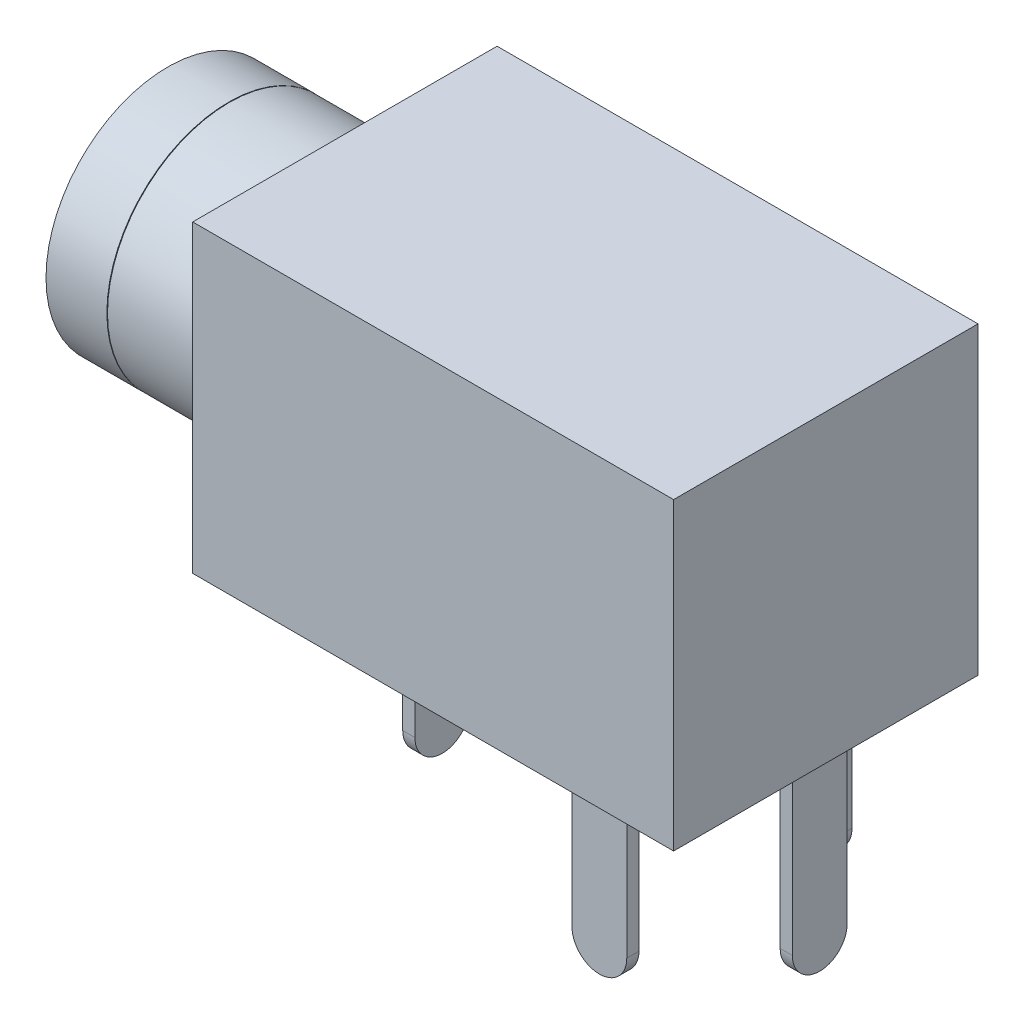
SolidWorks part; units mm, degrees
ref_plane "Plan de face" through (0, 0, 0) normal (0, 0, 1) x (1, 0, 0)
ref_plane "Plan de dessus" through (0, 0, 0) normal (0, 1, 0) x (1, 0, 0)
ref_plane "Plan de droite" through (0, 0, 0) normal (1, 0, 0) x (0, 0, -1)
sketch "Esquisse1" plane through (0, 0, 0) normal (0, 1, 0) x (1, 0, 0)
  line L0 (-30.098, 0) -> (57.1151, 0) construction
  line L1 (0, 29.2686) -> (0, -16.234) construction
  line L2 (7.9, 7.3044) -> (7.9, -5.7227) construction
  line L3 (9.698, -2.5) -> (-1.0178, -2.5) construction
  line L4 (-1.0178, 2.5) -> (8.9101, 2.5) construction
  line L6 (0, 2.5) -> (7.9, 2.5)
  line L7 (0, 2.5) -> (0, -2.5)
  line L8 (0, -2.5) -> (7.9, -2.5)
  line L9 (7.9, 2.5) -> (7.9, -2.5)
extrude "Extrusion1" add sketch "Esquisse1" along normal blind 5
sketch "Esquisse2" plane through (0, 0, 0) normal (-1, 0, 0) x (0, 0, 1)
  line L0 (0, 5.7815) -> (0, -1.692) construction
  line L2 (3.7431, 2.5) -> (-3.5154, 2.5) construction
  circle A0 centre (0, 2.5) radius 2
extrude "Extrusion2" add sketch "Esquisse2" along normal blind 1.9
sketch "Esquisse4" plane through (0, 0, 0) normal (0, -1, 0) x (1, 0, 0)
  line L0 (-2.2923, 0) -> (11.778, 0) construction
  line L1 (3.5, 3.1357) -> (3.5, -3.1172) construction
  circle A0 centre (3.5, 0) radius 0.5
extrude "Extrusion3" add sketch "Esquisse4" along normal blind 2
ref_plane "Plan1" through (-1.91, 0, 0) normal (-1, 0, 0) x (0, 0, 1)
sketch "Esquisse6" plane through (-1.91, 0, 0) normal (-1, 0, 0) x (0, 0, 1)
  line L0 (0, -2.184) -> (0, 5.2011) construction
  line L1 (-3.7566, 2.5) -> (3.3041, 2.5) construction
  circle A0 centre (0, 2.5) radius 2
  circle A1 centre (0, 2.5) radius 1.25
extrude "Extrusion5" add sketch "Esquisse6" along normal blind 1
ref_plane "Plan2" through (0, -0.01, 0) normal (0, -1, 0) x (1, 0, 0)
sketch "Esquisse7" plane through (0, -0.01, 0) normal (0, -1, 0) x (1, 0, 0)
  line L0 (-1.458, 0) -> (8.8422, 0) construction
  line L1 (1.5, 3.2856) -> (1.5, -1.7676) construction
  line L2 (7.6, 4.0905) -> (7.6, -1.7676) construction
  line L3 (6.0303, 3.8562) -> (6.0303, -4.0294) construction
  line L4 (3.3304, -1.75) -> (6.8351, -1.75) construction
  line L5 (5.5596, -1.65) -> (6.8098, -1.65) construction
  line L6 (6.4803, 1.65) -> (6.4803, 1.85)
  line L7 (6.4803, -1.5003) -> (6.4803, -2.0057) construction
  line L8 (5.5803, -1.65) -> (6.4803, -1.65)
  line L9 (6.8098, -1.85) -> (5.5596, -1.85) construction
  line L10 (5.5803, -1.65) -> (5.5803, -1.85)
  line L11 (5.5803, -2.0057) -> (5.5803, -1.5845) construction
  line L12 (5.5803, -1.85) -> (6.4803, -1.85)
  line L13 (6.4803, -1.65) -> (6.4803, -1.85)
  line L14 (5.5803, 1.85) -> (6.4803, 1.85)
  line L15 (5.5803, 1.65) -> (5.5803, 1.85)
  line L16 (5.5803, 1.65) -> (6.4803, 1.65)
  line L17 (7.8, 0.8865) -> (7.8, -1.65) construction
  line L18 (8.1222, -0.45) -> (0.8106, -0.45) construction
  line L19 (8.1222, 0.45) -> (1.002, 0.45) construction
  line L20 (1.4, 0.8865) -> (1.4, -1.302) construction
  line L21 (1.6, 0.8865) -> (1.6, -1.302) construction
  line L23 (7.6, 0.45) -> (7.8, 0.45)
  line L24 (7.6, 0.45) -> (7.6, -0.45)
  line L25 (7.6, -0.45) -> (7.8, -0.45)
  line L26 (7.8, 0.45) -> (7.8, -0.45)
  line L27 (1.4, 0.45) -> (1.6, 0.45)
  line L28 (1.4, 0.45) -> (1.4, -0.45)
  line L29 (1.4, -0.45) -> (1.6, -0.45)
  line L30 (1.6, 0.45) -> (1.6, -0.45)
  dimension "D1" = 0.1
  dimension "D2" = 0.1
  dimension "D3" = 0.45
  dimension "D4" = 0.9
  dimension "D5" = 0.45
  dimension "D6" = 0.9
  dimension "D7" = 0.2
  dimension "D8" = 0.1
  dimension "D9" = 0.1
extrude "Extrusion6" add sketch "Esquisse7" along normal blind 3
fillet "Congé1" radius 0.45 2 edges at (1.5, -3.01, 0.45) (1.5, -3.01, -0.45)
fillet "Congé2" radius 0.45 2 edges at (6.4803, -3.01, -1.75) (5.5803, -3.01, -1.75)
fillet "Congé3" radius 0.45 2 edges at (7.7, -3.01, 0.45) (7.7, -3.01, -0.45)
fillet "Congé4" radius 0.45 2 edges at (5.5803, -3.01, 1.75) (6.4803, -3.01, 1.75)
